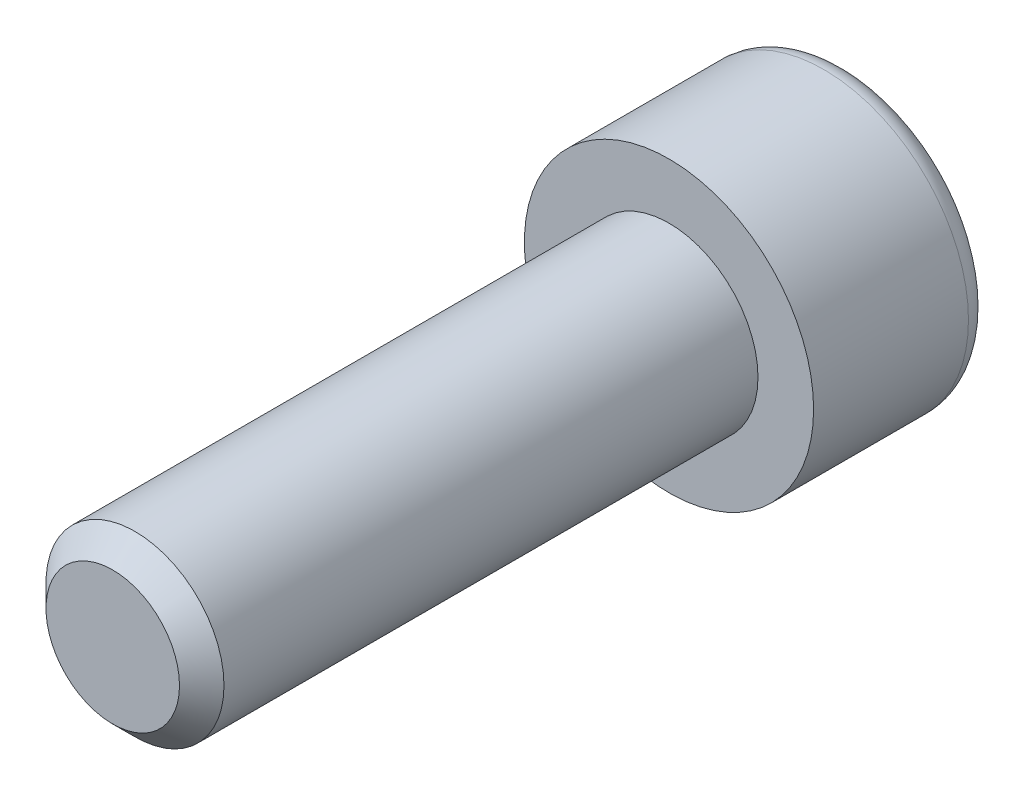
SolidWorks part; units mm, degrees
ref_plane "Plan1" through (0, 0, 0) normal (0, 0, 1) x (1, 0, 0)
ref_plane "Plan2" through (0, 0, 0) normal (0, 1, 0) x (1, 0, 0)
ref_plane "Plan3" through (0, 0, 0) normal (1, 0, 0) x (0, 0, -1)
sketch "Esquisse1" plane through (0, 0, 0) normal (0, 0, 1) x (1, 0, 0)
  circle A0 centre (0, 0) radius 4
extrude "Corps" add sketch "Esquisse1" along normal blind 25
sketch "Esquisse2" plane through (0, 0, 0) normal (0, 0, 1) x (1, 0, 0)
  circle A0 centre (0, 0) radius 6.5
extrude "Tete" add sketch "Esquisse2" against normal blind 8
ref_plane "Plan4" through (0, 0, -8) normal (0, 0, 1) x (1, 0, 0)
sketch "Esquisse3" plane through (0, 0, -8) normal (0, 0, 1) x (1, 0, 0)
  line L1 (0, -3.4641) -> (3, -1.7321)
  line L2 (3, -1.7321) -> (3, 1.7321)
  line L3 (3, 1.7321) -> (0, 3.4641)
  line L4 (0, 3.4641) -> (-3, 1.7321)
  line L5 (-3, 1.7321) -> (-3, -1.7321)
  line L6 (-3, -1.7321) -> (0, -3.4641)
  circle A0 centre (0, 0) radius 3 construction
  dimension "D1" = 6
extrude "6pans" cut sketch "Esquisse3" along normal blind 5.6
chamfer "Chanfrein2" distance 1 angle 45 1 edges at (4, 0, 25)
fillet "Congé1" radius 1.04 1 edges at (6.5, 0, -8)
equation "\"D1@Congé1\"=\"D1@Esquisse2\"*0.08"
equation "\"D1@Chanfrein2\"=\"D@Esquisse1\"*0.15"
equation "\"HT@6pans\"=\"HT@Tete\"*0.7"
equation "\"D1@Plan4\" = \"HT@Tete\""
